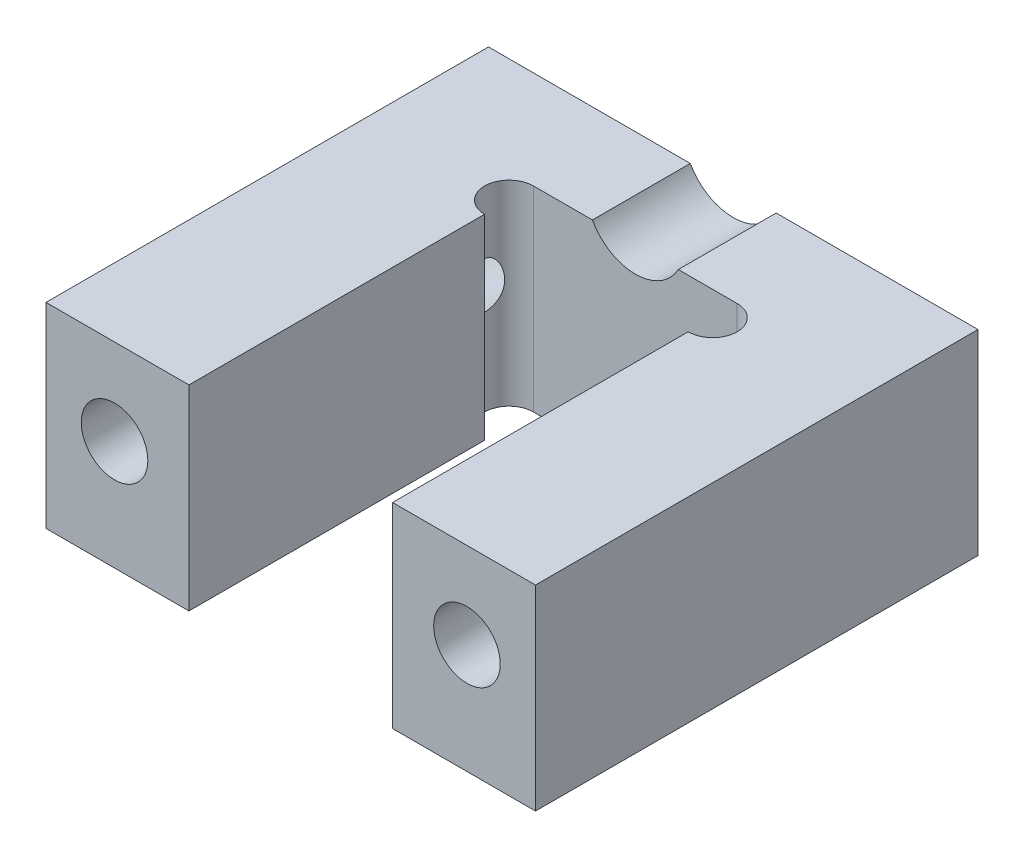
SolidWorks part; units mm, degrees
ref_plane "Front Plane" through (0, 0, 0) normal (0, 0, 1) x (1, 0, 0)
ref_plane "Top Plane" through (0, 0, 0) normal (0, 1, 0) x (1, 0, 0)
ref_plane "Right Plane" through (0, 0, 0) normal (1, 0, 0) x (0, 0, -1)
sketch "Sketch1" plane through (0, 0, 0) normal (0, 0, 1) x (1, 0, 0)
  line L1 (0, 0) -> (31.75, 0)
  line L2 (0, 0) -> (0, 12.7)
  line L3 (0, 12.7) -> (31.75, 12.7)
  line L4 (31.75, 0) -> (31.75, 12.7)
  dimension "D1" = 31.75
  dimension "D2" = 12.7
extrude "Extrude1" add sketch "Sketch1" along normal blind 28.702
sketch "Sketch2" plane through (0, 0, 28.702) normal (0, 0, 1) x (1, 0, 0)
  line L0 (15.875, 0) -> (15.875, 12.7) construction
  line L1 (0, 0) -> (31.75, 0) construction
  line L2 (31.75, 12.7) -> (0, 12.7) construction
  line L3 (22.479, 12.7) -> (22.479, 0)
  line L4 (9.271, 12.7) -> (9.271, 0)
  line L5 (9.271, 12.7) -> (22.479, 12.7)
  line L6 (9.271, 0) -> (22.479, 0)
  dimension "D1" = 6.604
extrude "cut_out" cut sketch "Sketch2" against normal blind 22.352
sketch "Sketch3" plane through (0, 0, 0) normal (0, 0, -1) x (-1, 0, 0)
  line L0 (-15.875, 0) -> (-15.875, 12.7) construction
  line L1 (0, 0) -> (-31.75, 0) construction
  line L2 (-31.75, 12.7) -> (0, 12.7) construction
  circle A0 centre (-27.305, 7.112) radius 2.159
  circle A1 centre (-4.445, 7.112) radius 2.159
  dimension "D2" = 4.318
  dimension "D3" = 7.112
  dimension "D1" = 11.43
extrude "thru_holes" cut sketch "Sketch3" against normal through all
sketch "Sketch4" plane through (0, 0, 0) normal (0, 0, -1) x (-1, 0, 0)
  circle A0 centre (-27.305, 7.112) radius 3.5687
  circle A2 centre (-4.445, 7.112) radius 3.5687
  dimension "D1" = 7.1374
  dimension "D2" = 7.1374
extrude "cbore" cut sketch "Sketch4" against normal blind 17.78
sketch "Sketch5" plane through (0, 12.7, 0) normal (0, 1, 0) x (-1, 0, 0)
  line L1 (-15.875, 6.35) -> (-15.875, 12.7021) construction
  line L2 (-22.479, 6.35) -> (-9.271, 6.35) construction
  line L3 (-22.479, 6.35) -> (-22.479, 7.9375) construction
  line L4 (-22.479, 6.35) -> (-22.479, 28.702) construction
  line L5 (-22.479, 9.525) -> (-15.875, 9.5261)
  line L6 (-22.479, 6.35) -> (-9.271, 6.35)
  line L7 (-9.271, 9.525) -> (-15.875, 9.5261)
  arc A0 (-22.479, 9.525) -> (-22.479, 6.35) centre (-22.479, 7.9375) ccw
  arc A1 (-9.271, 9.525) -> (-9.271, 6.35) centre (-9.271, 7.9375) cw
  dimension "D1" = 1.5875
extrude "Cut-Extrude1" cut sketch "Sketch5" against normal through all
sketch "Sketch6" plane through (0, 0, 0) normal (0, 0, -1) x (-1, 0, 0)
  line L0 (-15.875, 12.7) -> (-15.875, 0) construction
  line L1 (-31.75, 12.7) -> (0, 12.7) construction
  line L2 (0, 0) -> (-31.75, 0) construction
  line L3 (-15.875, 12.7) -> (-15.875, 14.224) construction
  circle A0 centre (-15.875, 14.224) radius 3.175
  dimension "D2" = 6.35
  dimension "D1" = 1.524
extrude "Cut-Extrude2" cut sketch "Sketch6" against normal blind 12.7
